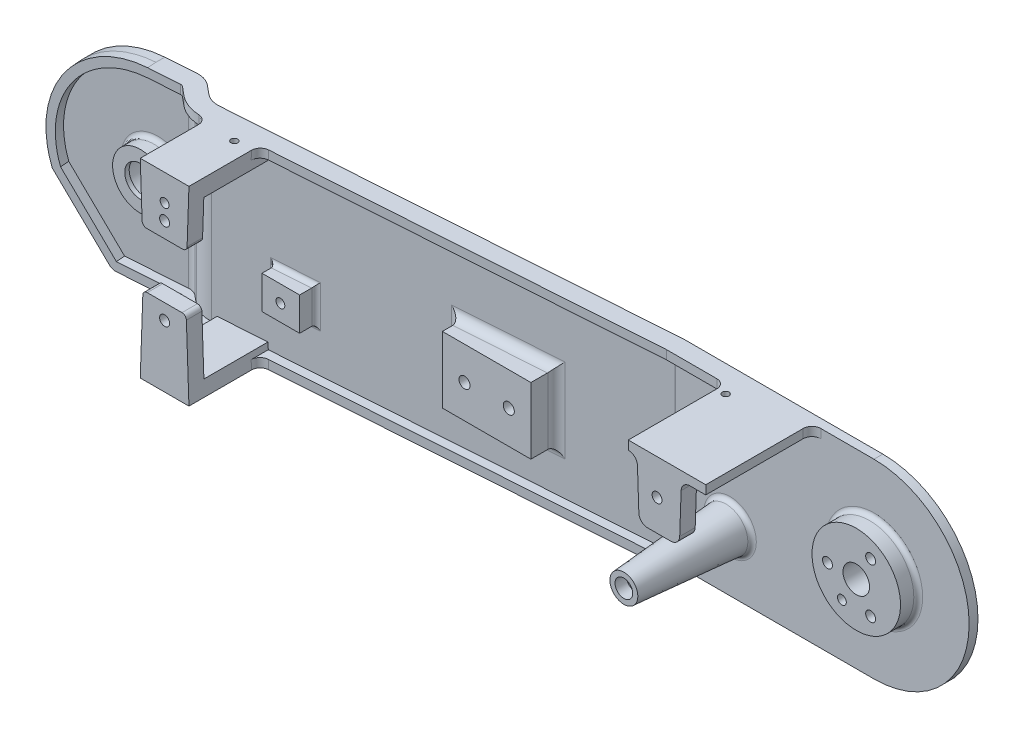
SolidWorks part; units mm, degrees
ref_plane "Plan de face" through (0, 0, 0) normal (0, 0, 1) x (1, 0, 0)
ref_plane "Plan de dessus" through (0, 0, 0) normal (0, 1, 0) x (1, 0, 0)
ref_plane "Plan de droite" through (0, 0, 0) normal (1, 0, 0) x (0, 0, -1)
inserted part "avt bras droit01<1>@Assemblage1"
sketch "Esquisse2" plane through (0, 0, 0) normal (0, 0, 1) x (1, 0, 0)
  line L0 (-283.5, 43) -> (-282.6595, 18.9302)
  line L1 (-89.7206, 43) -> (-285.4403, 43) construction
  line L2 (-280.6607, 17) -> (-264.3393, 17)
  line L3 (-262.3405, 18.9302) -> (-261.5, 43)
  line L4 (-261.5, 43) -> (-283.5, 43)
  line L5 (-272.5, 72.3217) -> (-272.5, -3.6699) construction
  line L6 (-261.5, 92.2605) -> (-261.5, -33.5548) construction
  line L7 (-282.5921, 90.6779) -> (-282.5921, -30.1645) construction
  arc A0 (-280.6607, 17) -> (-282.6595, 18.9302) centre (-280.6607, 19) cw
  arc A1 (-262.3405, 18.9302) -> (-264.3393, 17) centre (-264.3393, 19) cw
  point P15 (-282.5921, 17)
  dimension "D6" = 2
  dimension "D7" = 2
  dimension "D1" = 22
  dimension "D2" = 11
  dimension "D3" = 272.5
  dimension "D4" = 2
  dimension "D5" = 2
  dimension "D8" = 26
extrude "Extrusion1" add sketch "Esquisse2" along normal blind 56
sketch "Esquisse3" plane through (0, 43, 0) normal (0, 1, 0) x (-1, 0, 0)
  line L0 (261.5, 11.9924) -> (283.5, 13.5308)
  line L1 (283.5, 13.5308) -> (283.5, 0)
  line L2 (283.5, 0) -> (261.5, 0)
  line L3 (261.5, 0) -> (261.5, 11.9924)
extrude "Enlèv. mat.-Extru.1" cut sketch "Esquisse3" against normal through all
sketch "Esquisse6" plane through (0, 17, 0) normal (0, -1, 0) x (1, 0, 0)
  line L0 (-264.7148, 16.227) -> (-258.0219, 15.759) construction
  line L1 (-280.6607, 17.3421) -> (-264.3393, 16.2008) construction
  line L2 (-258.0219, 15.759) -> (-285.1238, 17.6541) construction
  line L3 (-283.5387, 17.5433) -> (-260.9848, 15.9662)
  line L4 (-260.9848, 15.9662) -> (-260.9848, 45)
  line L5 (-260.9848, 45) -> (-283.5387, 45)
  line L6 (-283.5387, 45) -> (-283.5387, 17.5433)
  line L7 (-280.6607, 56) -> (-264.3393, 56) construction
  dimension "D1" = 11
extrude "Enlèv. mat.-Extru.3" cut sketch "Esquisse6" against normal blind 18
sketch "Esquisse8" plane through (0, 0, 56) normal (0, 0, 1) x (1, 0, 0)
  line L0 (-283.5, -43) -> (-261.5, -43)
  line L1 (-285.4403, -43) -> (-87.4759, -43) construction
  line L2 (-261.5, -43) -> (-262.6548, -9.9302)
  line L3 (-264.6536, -8) -> (-280.3464, -8)
  line L4 (-282.3452, -9.9302) -> (-283.5, -43)
  line L5 (-272.5, 56.3461) -> (-272.5, -71.7255) construction
  line L6 (-283.5, -2.5567) -> (-283.5, -61.1241) construction
  line L7 (-261.5, 6.465) -> (-261.5, -60.2367) construction
  arc A0 (-282.3452, -9.9302) -> (-280.3464, -8) centre (-280.3464, -10) cw
  arc A1 (-262.6548, -9.9302) -> (-264.6536, -8) centre (-264.6536, -10) ccw
  dimension "D4" = 2
  dimension "D1" = 22
  dimension "D2" = 11
  dimension "D3" = 272.5
  dimension "D5" = 2
  dimension "D6" = 2
  dimension "D7" = 35
extrude "Extrusion2" add sketch "Esquisse8" against normal up to next
sketch "Esquisse9" plane through (0, -8, 0) normal (0, 1, 0) x (-1, 0, 0)
  line L0 (279.6459, 17.2711) -> (289.4305, 17.9553) construction
  line L2 (264.6536, 16.2227) -> (280.3464, 17.3201) construction
  line L3 (289.4305, 17.9553) -> (260.9602, 15.9645) construction
  line L4 (260.9602, 15.9645) -> (284.5382, 17.6132)
  line L5 (284.5382, 17.6132) -> (284.5382, 45)
  line L6 (284.5382, 45) -> (260.9602, 45)
  line L7 (260.9602, 45) -> (260.9602, 15.9645)
  line L8 (264.6536, 56) -> (280.3464, 56) construction
  dimension "D1" = 11
extrude "Enlèv. mat.-Extru.4" cut sketch "Esquisse9" against normal blind 28
sketch "Esquisse10" plane through (0, 0, 4) normal (0, 0, 1) x (1, 0, 0)
  line L0 (-250, 20.9787) -> (-250, -99.7083) construction
  line L1 (-258.5, -4.5) -> (-241.5, -4.5)
  line L2 (-258.5, -4.5) -> (-258.5, -19.5)
  line L3 (-258.5, -19.5) -> (-241.5, -19.5)
  line L4 (-241.5, -4.5) -> (-241.5, -19.5)
  line L5 (-276.2948, -12) -> (-204.1654, -12) construction
  dimension "D1" = 17
  dimension "D2" = 15
  dimension "D3" = 8.5
  dimension "D4" = 7.5
  dimension "D5" = 12
  dimension "D6" = 250
extrude "Extrusion3" add sketch "Esquisse10" along normal blind 18
sketch "Esquisse11" plane through (0, -4.5, 0) normal (0, 1, 0) x (-1, 0, 0)
  line L0 (241.5, 10.5939) -> (241.5, 4)
  line L1 (241.5, 4) -> (258.5, 4)
  line L2 (258.5, 4) -> (258.5, 11.7827)
  line L3 (258.5, 11.7827) -> (241.5, 10.5939)
extrude "Enlèv. mat.-Extru.5" cut sketch "Esquisse11" against normal through all
fillet "Congé1" radius 2 4 edges at (-258.5, -12, 15.7924) (-250, -19.5, 15.1981) (-250, -4.5, 15.1981) (-241.5, -12, 14.6037)
fillet "Congé2" radius 4 5 edges at (-285.4403, 41, 21.6861) (-63, 41, 8) (-28, 41, 4) (-283.4302, 41, 21.5455) (-261.5698, 41, 20.0169)
fillet "Congé3" radius 4 3 edges at (-285.4403, -41, 21.6861) (-261.5698, -41, 20.0169) (-283.4302, -41, 21.5455)
ref_plane "Plan1" through (0, 0, 6) normal (0, 0, -1) x (-1, 0, 0)
sketch "Esquisse12" plane through (0, 0, 6) normal (0, 0, -1) x (-1, 0, 0)
  line L0 (393.3523, 0) -> (-164.8619, 0) construction
  line L2 (300, 10) -> (150, 10)
  line L3 (300, 10) -> (300, -10)
  line L4 (300, -10) -> (150, -10)
  line L5 (150, 10) -> (150, -10)
  dimension "D1" = 150
  dimension "D2" = 10
  dimension "D3" = 20
  dimension "D4" = 300
extrude "Extrusion4" add sketch "Esquisse12" against normal up to body separate body
sketch "Esquisse13" plane through (0, 0, 12) normal (0, 0, 1) x (1, 0, 0)
  circle A0 centre (0, 0) radius 6
extrude "Enlèv. mat.-Extru.6" cut sketch "Esquisse13" against normal through all
sketch "Esquisse14" plane through (0, 0, 0) normal (0, 0, -1) x (-1, 0, 0)
  circle A0 centre (0, 0) radius 7.5
extrude "Enlèv. mat.-Extru.7" cut sketch "Esquisse14" against normal blind 1
sketch "Esquisse16" plane through (0, 0, 0) normal (0, 0, -1) x (-1, 0, 0)
  circle A0 centre (317.5, 0) radius 12.5
  dimension "D1" = 25
extrude "Extrusion5" add sketch "Esquisse16" against normal blind 18
sketch "Esquisse17" plane through (0, 43, 0) normal (0, 1, 0) x (-1, 0, 0)
  line L0 (295, 5) -> (340, 5) construction
  line L1 (303.1093, 5) -> (333.3189, 5)
  line L2 (303.1093, 5) -> (303.1093, -2.7136)
  line L3 (303.1093, -2.7136) -> (333.3189, -2.7136)
  line L4 (333.3189, 5) -> (333.3189, -2.7136)
extrude "Enlèv. mat.-Extru.9" cut sketch "Esquisse17" against normal blind 110
fillet "Congé4" radius 2 1 edges at (-305, 0, 10.038)
sketch "Esquisse19" plane through (0, 0, 5) normal (0, 0, -1) x (-1, 0, 0)
  circle A0 centre (317.5, 0) radius 9
extrude "Enlèv. mat.-Extru.10" cut sketch "Esquisse19" against normal blind 11
sketch "Esquisse20" plane through (0, 0, 18) normal (0, 0, 1) x (1, 0, 0)
  circle A0 centre (-317.5, 0) radius 7
  dimension "D1" = 14
  dimension "D2" = 317.5
extrude "Enlèv. mat.-Extru.11" cut sketch "Esquisse20" against normal blind 11
sketch "Esquisse21" plane through (0, 0, 56) normal (0, 0, 1) x (1, 0, 0)
  line L0 (-262.3405, 18.9302) -> (-261.5, 43) construction
  line L1 (-280.6607, 17) -> (-264.3393, 17) construction
  line L2 (-283.5, 43) -> (-282.6595, 18.9302) construction
  line L3 (-261.5, 43) -> (-283.5, 43) construction
  line L4 (-262.3405, 18.9302) -> (-261.5, 43)
  line L5 (-280.6607, 17) -> (-264.3393, 17)
  line L6 (-283.5, 43) -> (-282.6595, 18.9302)
  line L7 (-261.5, 43) -> (-283.5, 43)
  arc A0 (-282.6595, 18.9302) -> (-280.6607, 17) centre (-280.6607, 19) ccw construction
  arc A1 (-264.3393, 17) -> (-262.3405, 18.9302) centre (-264.3393, 19) ccw construction
  arc A2 (-282.6595, 18.9302) -> (-280.6607, 17) centre (-280.6607, 19) ccw
  arc A3 (-264.3393, 17) -> (-262.3405, 18.9302) centre (-264.3393, 19) ccw
extrude "Enlèv. mat.-Extru.12" cut sketch "Esquisse21" against normal blind 4
sketch "Esquisse22" plane through (0, 0, 56) normal (0, 0, 1) x (1, 0, 0)
  line L0 (-282.3452, -9.9302) -> (-283.5, -43) construction
  line L1 (-261.5, -43) -> (-262.6548, -9.9302) construction
  line L2 (-283.5, -43) -> (-261.5, -43) construction
  line L3 (-264.6536, -8) -> (-280.3464, -8) construction
  line L4 (-282.3452, -9.9302) -> (-283.5, -43)
  line L5 (-261.5, -43) -> (-262.6548, -9.9302)
  line L6 (-283.5, -43) -> (-261.5, -43)
  line L7 (-264.6536, -8) -> (-280.3464, -8)
  arc A0 (-262.6548, -9.9302) -> (-264.6536, -8) centre (-264.6536, -10) ccw construction
  arc A1 (-280.3464, -8) -> (-282.3452, -9.9302) centre (-280.3464, -10) ccw construction
  arc A2 (-262.6548, -9.9302) -> (-264.6536, -8) centre (-264.6536, -10) ccw
  arc A3 (-280.3464, -8) -> (-282.3452, -9.9302) centre (-280.3464, -10) ccw
extrude "Enlèv. mat.-Extru.13" cut sketch "Esquisse22" against normal blind 4
sketch "Esquisse24" plane through (0, 0, 56) normal (0, 0, 1) x (1, 0, 0)
  line L1 (-77.2613, -7.344) -> (-55.4178, -7.344)
  line L2 (-77.2613, -7.344) -> (-77.2613, -23.5965)
  line L3 (-77.2613, -23.5965) -> (-55.4178, -23.5965)
  line L4 (-55.4178, -7.344) -> (-55.4178, -23.5965)
extrude "Enlèv. mat.-Extru.15" cut sketch "Esquisse24" against normal blind 4
sketch "Esquisse25" plane through (0, 0, 56) normal (0, 0, 1) x (1, 0, 0)
  line L1 (-70.0188, 45.0575) -> (-18.9725, 45.0575)
  line L2 (-70.0188, 45.0575) -> (-70.0188, 6.2078)
  line L3 (-70.0188, 6.2078) -> (-18.9725, 6.2078)
  line L4 (-18.9725, 45.0575) -> (-18.9725, 6.2078)
extrude "Enlèv. mat.-Extru.16" cut sketch "Esquisse25" against normal blind 4
sketch "Esquisse26" plane through (0, 0, 49) normal (0, 0, -1) x (-1, 0, 0)
  line L0 (58.2269, 16.8604) -> (58.7929, 33.0686) construction
  line L1 (43.7707, 13) -> (54.2293, 13) construction
  line L2 (39.231, 32.3855) -> (39.7731, 16.8604) construction
  line L3 (39.231, 32.3855) -> (39.7731, 16.8604)
  line L4 (43.7707, 13) -> (54.2293, 13)
  line L5 (58.2269, 16.8604) -> (58.7929, 33.0686)
  line L6 (58.7929, 33.0686) -> (39.231, 32.3855)
  arc A0 (54.2293, 13) -> (58.2269, 16.8604) centre (54.2293, 17) ccw construction
  arc A1 (39.7731, 16.8604) -> (43.7707, 13) centre (43.7707, 17) ccw construction
  arc A2 (39.7731, 16.8604) -> (43.7707, 13) centre (43.7707, 17) ccw
  arc A3 (54.2293, 13) -> (58.2269, 16.8604) centre (54.2293, 17) ccw
extrude "Extrusion6" add sketch "Esquisse26" along normal blind 4
sketch "Esquisse27" plane through (0, 0, 52) normal (0, 0, 1) x (1, 0, 0)
  point P0 (-65, -16)
hole_wizard "Trou taraudé M6x1.01" positions "Esquisse3D1" profile "Esquisse29" tap size "M6x1.0" standard "Ansi Métrique"
sketch3d "Esquisse3D1"
  point P0 (-65, -16, 52)
sketch "Esquisse29" plane through (-65, -16, 52) normal (1, 0, 0) x (0, -1, 0)
  line L0 (0, 0) -> (0, 32.0022)
  line L1 (0, 32.0022) -> (2.5, 30.5)
  line L2 (2.5, 30.5) -> (2.5, 27.5)
  line L3 (2.5, 27.5) -> (3, 27.5)
  line L4 (3, 27.5) -> (3, 0)
  line L5 (3, 0) -> (0, 0)
  line L10 (0, 32.0022) -> (-2.5, 30.5) construction
  line L11 (0, -6.35) -> (0, 107.95) construction
  dimension "Diamètre du trou pour taraudage" = 5
  dimension "Profondeur du trou pour taraudage" = 30.5
  dimension "Diamètre principal du filetage" = 6
  dimension "Profondeur du filetage" = 27.5
  dimension "Angle de pointe" = 118
sketch "Esquisse30" plane through (0, 0, 52) normal (0, 0, 1) x (1, 0, 0)
  circle A0 centre (-65, -16) radius 4
  point P0 (-65, -16)
  dimension "D1" = 8
extrude "Enlèv. mat.-Extru.17" cut sketch "Esquisse30" against normal blind 5.2
sketch "Esquisse31" plane through (0, 0, 12) normal (0, 0, 1) x (1, 0, 0)
  circle A2 centre (-13, 0) radius 2.25
  circle A3 centre (6.5, 11.2583) radius 2.25
  circle A4 centre (6.5, -11.2583) radius 2.25
  circle A5 centre (-6.5, -11.2583) radius 2
  point P3 (-13, 0)
  point P4 (6.5, -11.2583)
  point P5 (6.5, 11.2583)
  point P12 (-6.5, -11.2583)
  dimension "D1" = 4.5
  dimension "D2" = 4.5
  dimension "D3" = 4.5
  dimension "D4" = 4
extrude "Enlèv. mat.-Extru.18" cut sketch "Esquisse31" against normal blind 15
sketch "Esquisse32" plane through (0, 0, 52) normal (0, 0, 1) x (1, 0, 0)
  line L0 (0, 0) -> (0, 187.7335) construction
  line L1 (-272.5, 121.7445) -> (-272.5, -60.0553) construction
  line L2 (0, 0) -> (-384.5238, 0) construction
  line L3 (-384.5238, 31) -> (50.4362, 31) construction
  line L4 (-314.2482, 24) -> (-198.3729, 24) construction
  line L6 (-280.6607, 17) -> (-264.3393, 17) construction
  line L10 (-339.1881, -15) -> (-202.5316, -15) construction
  line L11 (-264.6536, -8) -> (-280.3464, -8) construction
  line L12 (-50, 72.1966) -> (-50, -116.9978) construction
  line L13 (-250, 84.9944) -> (-250, -49.6147) construction
  line L14 (-267.4938, -12) -> (-225.854, -12) construction
  line L15 (-150, 79.1102) -> (-150, -91.0239) construction
  line L16 (-170, 79.1102) -> (-170, -106.2804) construction
  line L17 (-192.7656, -4.5) -> (-122.4928, -4.5) construction
  line L18 (-79.6954, 27) -> (-19.1019, 27) construction
  line L19 (0, 43) -> (-90, 43) construction
  circle A0 centre (-272.5, 31) radius 2
  circle A1 centre (-272.5, 24) radius 2.25
  circle A2 centre (-272.5, -15) radius 2.25
  circle A3 centre (-50, 27) radius 2.25
  point P31 (-250, -12)
  point P38 (-150, -4.5)
  point P39 (-170, -4.5)
  point P40 (-45, 43)
  dimension "D4" = 4
  dimension "D5" = 4.5
  dimension "D7" = 4.5
  dimension "D8" = 50
  dimension "D9" = 16
  dimension "D15" = 4.5
  dimension "D1" = 272.5
  dimension "D2" = 7
  dimension "D3" = 7
  dimension "D6" = 7
  dimension "D10" = 250
  dimension "D11" = 12
  dimension "D12" = 150
  dimension "D13" = 20
  dimension "D14" = 4.5
extrude "Enlèv. mat.-Extru.19" cut sketch "Esquisse32" against normal blind 15
hole_wizard "Trou taraudé M4x0.71" positions "Esquisse39" profile "Esquisse38" tap size "M4x0.7" standard "Ansi Métrique"
sketch "Esquisse39" plane through (0, 0, 22) normal (0, 0, 1) x (1, 0, 0)
  point P0 (-250.1948, -12.0895)
sketch "Esquisse38" plane through (-250.1948, -12.0895, 22) normal (1, 0, 0) x (0, -1, 0)
  line L0 (0, 0) -> (0, 10.7914)
  line L1 (0, 10.7914) -> (1.65, 9.8)
  line L2 (1.65, 9.8) -> (1.65, 8)
  line L3 (1.65, 8) -> (2, 8)
  line L4 (2, 8) -> (2, 0)
  line L5 (2, 0) -> (0, 0)
  line L10 (0, 10.7914) -> (-1.65, 9.8) construction
  line L11 (0, -6.35) -> (0, 107.95) construction
  dimension "Diamètre du trou pour taraudage" = 3.3
  dimension "Profondeur du trou pour taraudage" = 9.8
  dimension "Diamètre principal du filetage" = 4
  dimension "Profondeur du filetage" = 8
  dimension "Angle de pointe" = 118
hole_wizard "Trou taraudé M5x0.81" positions "Esquisse41" profile "Esquisse40" tap size "M5x0.8" standard "Ansi Métrique"
sketch "Esquisse41" plane through (0, 0, 19) normal (0, 0, 1) x (1, 0, 0)
  point P0 (-169.9856, -4.4914)
sketch "Esquisse40" plane through (-169.9856, -4.4914, 19) normal (1, 0, 0) x (0, -1, 0)
  line L0 (0, 0) -> (0, 13.2618)
  line L1 (0, 13.2618) -> (2.1, 12)
  line L2 (2.1, 12) -> (2.1, 10)
  line L3 (2.1, 10) -> (2.5, 10)
  line L4 (2.5, 10) -> (2.5, 0)
  line L5 (2.5, 0) -> (0, 0)
  line L10 (0, 13.2618) -> (-2.1, 12) construction
  line L11 (0, -6.35) -> (0, 107.95) construction
  dimension "Diamètre du trou pour taraudage" = 4.2
  dimension "Profondeur du trou pour taraudage" = 12
  dimension "Diamètre principal du filetage" = 5
  dimension "Profondeur du filetage" = 10
  dimension "Angle de pointe" = 118
hole_wizard "Trou taraudé M5x0.82" positions "Esquisse43" profile "Esquisse42" tap size "M5x0.8" standard "Ansi Métrique"
sketch "Esquisse43" plane through (0, 0, 19) normal (0, 0, 1) x (1, 0, 0)
  point P0 (-149.9949, -4.5641)
sketch "Esquisse42" plane through (-149.9949, -4.5641, 19) normal (1, 0, 0) x (0, -1, 0)
  line L0 (0, 0) -> (0, 13.6618)
  line L1 (0, 13.6618) -> (2.1, 12.4)
  line L2 (2.1, 12.4) -> (2.1, 10)
  line L3 (2.1, 10) -> (2.5, 10)
  line L4 (2.5, 10) -> (2.5, 0)
  line L5 (2.5, 0) -> (0, 0)
  line L10 (0, 13.6618) -> (-2.1, 12.4) construction
  line L11 (0, -6.35) -> (0, 107.95) construction
  dimension "Diamètre du trou pour taraudage" = 4.2
  dimension "Profondeur du trou pour taraudage" = 12.4
  dimension "Diamètre principal du filetage" = 5
  dimension "Profondeur du filetage" = 10
  dimension "Angle de pointe" = 118
sketch "Esquisse44" plane through (0, 43, 0) normal (0, 1, 0) x (-1, 0, 0)
  line L0 (28, 52) -> (63, 52) construction
  line L2 (63, 52) -> (63, 12) construction
  line L3 (261.5, 52) -> (283.5, 52) construction
  circle A0 centre (59, 12) radius 1.5
  circle A1 centre (269, 24) radius 1.5
  dimension "D1" = 40
  dimension "D2" = 4
  dimension "D3" = 28
  dimension "D4" = 210
extrude "Enlèv. mat.-Extru.20" cut sketch "Esquisse44" against normal blind 8
